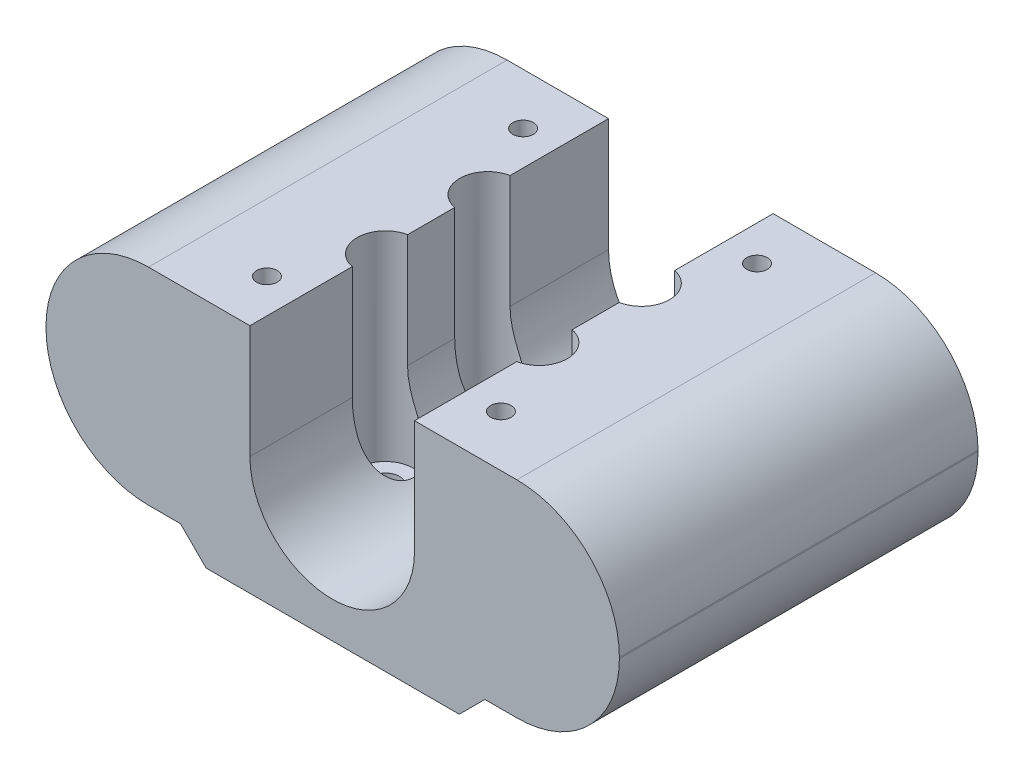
SolidWorks part; units mm, degrees
ref_plane "Front Plane" through (0, 0, 0) normal (0, 0, 1) x (1, 0, 0)
ref_plane "Top Plane" through (0, 0, 0) normal (0, 1, 0) x (1, 0, 0)
ref_plane "Right Plane" through (0, 0, 0) normal (1, 0, 0) x (0, 0, -1)
sketch "Sketch1" plane through (0, 0, 0) normal (0, 1, 0) x (1, 0, 0)
  line L1 (-10.4576, 12.6421) -> (9.5424, 12.6421)
  line L2 (-10.4576, 12.6421) -> (-10.4576, -15.3579)
  line L3 (-10.4576, -15.3579) -> (9.5424, -15.3579)
  line L4 (9.5424, 12.6421) -> (9.5424, -15.3579)
  dimension "D1" = 28
  dimension "D2" = 20
extrude "Boss-Extrude1" add sketch "Sketch1" along normal blind 18.1
sketch "Sketch3" plane through (0, 0, 15.3579) normal (0, 0, 1) x (1, 0, 0)
  line L0 (9.5424, 18.1) -> (9.5424, 0) construction
  line L1 (-10.4576, 0) -> (9.5424, 0) construction
  line L2 (-6.8826, 9.25) -> (-6.8826, 18.1)
  line L3 (-10.4576, 18.1) -> (9.5424, 18.1) construction
  line L4 (5.9674, 9.25) -> (5.9674, 18.1)
  line L5 (5.9674, 18.1) -> (-6.8826, 18.1)
  line L6 (-6.8826, 18.1) -> (5.9674, 18.1)
  circle A0 centre (-0.4576, 9.25) radius 6.425
  dimension "D1" = 12.85
  dimension "D2" = 10
  dimension "D3" = 9.25
extrude "Cut-Extrude1" cut sketch "Sketch3" against normal through all contours A0 L4 L2 M4 | A0
sketch "Sketch4" plane through (0, 18.1, 0) normal (0, -1, 0) x (1, 0, 0)
  line L1 (7.5424, -5.6421) -> (-8.4576, -5.6421)
  line L2 (7.5424, -5.6421) -> (7.5424, 8.3579)
  line L3 (7.5424, 8.3579) -> (-8.4576, 8.3579)
  line L4 (-8.4576, -5.6421) -> (-8.4576, 8.3579)
  line L5 (9.5424, -12.6421) -> (-10.4576, -12.6421) construction
  line L6 (-10.4576, -12.6421) -> (-10.4576, 15.3579) construction
  point P8 (5.5424, -2.4921)
  point P9 (5.5424, 5.2079)
  point P10 (-6.4576, 5.2079)
  point P11 (-6.4576, -2.4921)
  dimension "D1" = 7
  dimension "D2" = 14
  dimension "D3" = 16
  dimension "D4" = 2
  dimension "D5" = 2
  dimension "D6" = 2
  dimension "D7" = 2
  dimension "D8" = 2
  dimension "D9" = 3.15
  dimension "D10" = 3.15
  dimension "D11" = 3.15
  dimension "D12" = 3.15
sketch "Sketch12" plane through (0, 0, 0) normal (0, -1, 0) x (1, 0, 0)
  line L1 (-8.4576, 8.3579) -> (7.5424, 8.3579)
  line L2 (-8.4576, 8.3579) -> (-8.4576, -5.6421)
  line L3 (-8.4576, -5.6421) -> (7.5424, -5.6421)
  line L4 (7.5424, 8.3579) -> (7.5424, -5.6421)
  point P6 (-6.4576, 5.2079)
  point P7 (-6.4576, -2.4921)
  point P9 (5.5424, -2.4921)
  point P11 (5.5424, 5.2079)
sketch3d "3DSketch2"
  line L1 (-8.4576, 4, 8.3579) -> (7.5424, 4, 8.3579)
  line L2 (-8.4576, 4, 8.3579) -> (-8.4576, 4, -5.6421)
  line L3 (-8.4576, 4, -5.6421) -> (7.5424, 4, -5.6421)
  line L4 (7.5424, 4, 8.3579) -> (7.5424, 4, -5.6421)
  point P6 (-6.4576, 4, 5.2079)
  point P7 (-6.4576, 4, -2.4921)
  point P9 (5.5424, 4, 5.2079)
  point P11 (5.5424, 4, -2.4921)
  point P13 (-6.4576, 4, 5.5079)
  point P15 (5.5424, 4, 5.5079)
  dimension "D1" = 4
  dimension "D2" = 14
  dimension "D3" = 2.85
  dimension "D4" = 2.85
hole_wizard "CBORE for M2 SHCS3" positions "Sketch19" profile "Sketch20" counterbore size "M2" standard "ANSI Metric"
sketch "Sketch19" plane through (0, 18.1, 0) normal (0, 1, 0) x (1, 0, 0)
  line L0 (9.5424, 12.6421) -> (5.9674, 12.6421) construction
  line L1 (-6.8826, 12.6421) -> (-10.4576, 12.6421) construction
  point P12 (-6.4576, -5.2079)
  point P15 (5.5424, -5.2079)
  point P21 (5.5424, 2.7921)
  point P23 (-6.4576, 2.7921)
  point P30 (0, 0)
  dimension "D1" = 9.85
  dimension "D2" = 9.85
sketch "Sketch20" plane through (-6.4576, 18.1, 5.2079) normal (1, 0, 0) x (0, 0, 1)
  line L0 (0, 0) -> (0, 18.1)
  line L1 (1.1, 17.975) -> (1.225, 18.1)
  line L2 (1.1, 17.975) -> (1.1, 15.6)
  line L3 (1.1, 15.6) -> (2.2, 15.6)
  line L4 (2.2, 15.6) -> (2.2, 0)
  line L5 (2.2, 0) -> (0, 0)
  line L11 (0, -6.35) -> (0, 107.95) construction
  line L12 (1.225, 18.1) -> (0, 18.1)
  line L13 (-1.1, 17.975) -> (-1.225, 18.1) construction
  dimension "Thru Hole Dia." = 2.2
  dimension "Thru Hole Depth" = 18.1
  dimension "C'Bore Dia." = 4.4
  dimension "C'Bore Depth" = 15.6
  dimension "Far C'Sink Dia." = 2.45
  dimension "Far C'Sink Angle" = 90
sketch "Sketch21" plane through (0, 18.1, 0) normal (0, 1, 0) x (1, 0, 0)
  line L1 (9.5424, -15.3579) -> (11.4622, -15.3579)
  line L2 (9.5424, -15.3579) -> (9.5424, 12.6421)
  line L3 (9.5424, 12.6421) -> (11.4622, 12.6421)
  line L4 (11.4622, -15.3579) -> (11.4622, 12.6421)
  line L5 (-10.4576, -15.3579) -> (-12.3023, -15.3579)
  line L6 (-10.4576, -15.3579) -> (-10.4576, 12.6421)
  line L7 (-10.4576, 12.6421) -> (-12.3023, 12.6421)
  line L8 (-12.3023, -15.3579) -> (-12.3023, 12.6421)
extrude "Boss-Extrude2" add sketch "Sketch21" against normal up to surface (18.1 mm away)
sketch "Sketch22" plane through (0, 18.1, 0) normal (0, 1, 0) x (1, 0, 0)
  line L0 (5.9674, -15.3579) -> (11.4622, -15.3579) construction
  line L1 (11.4622, -15.3579) -> (11.4622, 12.6421) construction
  line L3 (-12.3023, 12.6421) -> (-12.3023, -15.3579) construction
  line L4 (-12.3023, -15.3579) -> (-6.8826, -15.3579) construction
  line L5 (-6.8826, 12.6421) -> (-12.3023, 12.6421) construction
  line L6 (11.4622, 12.6421) -> (5.9674, 12.6421) construction
  point P0 (8.7122, -11.3579)
  point P1 (8.7122, 8.6421)
  point P2 (-9.5523, -11.3579)
  point P3 (-9.5523, 8.6421)
  dimension "D1" = 4
  dimension "D2" = 2.75
  dimension "D3" = 2.75
  dimension "D4" = 4
  dimension "D5" = 4
  dimension "D6" = 4
  dimension "D7" = 2.75
  dimension "D8" = 2.75
hole_wizard "M2x0.4 Tapped Hole1" positions "Sketch23" profile "Sketch25" tap size "M2x0.4" standard "ANSI Metric"
sketch "Sketch23" plane through (0, 18.1, 0) normal (0, 1, 0) x (1, 0, 0)
  point P0 (8.7122, 8.6421)
  point P3 (8.7122, -11.3579)
  point P6 (-9.5523, -11.3579)
  point P9 (-9.5523, 8.6421)
sketch "Sketch25" plane through (8.7122, 18.1, -8.6421) normal (1, 0, 0) x (0, 0, 1)
  line L0 (0, 0) -> (0, 3.5807)
  line L1 (0, 3.5807) -> (0.8, 3.1)
  line L2 (0.8, 3.1) -> (0.8, 0)
  line L5 (0.8, 0) -> (0, 0)
  line L10 (0, 3.5807) -> (-0.8, 3.1) construction
  line L11 (0, -6.35) -> (0, 107.95) construction
  dimension "Tap Drill Dia." = 1.6
  dimension "Tap Drill Depth" = 3.1
  dimension "Drill Angle" = 118
chamfer "Chamfer2" distance 2 angle 45 2 edges at (11.4622, 0, 1.3579) (-12.3023, 0, 1.3579)
sketch "Sketch26" plane through (-12.3023, 0, 0) normal (-1, 0, 0) x (0, 0, 1)
  line L0 (-12.6421, 18.1) -> (15.3579, 18.1) construction
  line L1 (-12.6421, 2) -> (15.3579, 2)
  line L2 (-12.6421, 2) -> (-12.6421, 18.1)
  line L3 (-12.6421, 18.1) -> (15.3579, 18.1)
  line L4 (15.3579, 2) -> (15.3579, 18.1)
  dimension "D1" = 28
extrude "Boss-Extrude3" add sketch "Sketch26" along normal blind 10.5
sketch "Sketch28" plane through (0, 0, -12.6421) normal (0, 0, -1) x (-1, 0, 0)
  line L0 (6.8826, 9.25) -> (6.8826, 18.1) construction
  line L1 (6.8826, 18.1) -> (22.8023, 18.1) construction
  circle A0 centre (16.8826, 9.25) radius 4.25
  dimension "D3" = 8.5
  dimension "D1" = 10
  dimension "D2" = 8.85
extrude "Cut-Extrude2" cut sketch "Sketch28" against normal blind 19
sketch "Sketch29" plane through (11.4622, 0, 0) normal (1, 0, 0) x (0, 0, -1)
  line L0 (-15.3579, 2) -> (12.6421, 2) construction
  line L1 (12.6421, 18.1) -> (-15.3579, 18.1)
  line L2 (12.6421, 18.1) -> (12.6421, 2)
  line L3 (12.6421, 2) -> (-15.3579, 2)
  line L4 (-15.3579, 18.1) -> (-15.3579, 2)
  dimension "D1" = 28
extrude "Boss-Extrude4" add sketch "Sketch29" along normal blind 10.5
sketch "Sketch30" plane through (0, 0, -12.6421) normal (0, 0, -1) x (-1, 0, 0)
  line L0 (-21.9622, 18.1) -> (-5.9674, 18.1) construction
  line L2 (-5.9674, 9.25) -> (-5.9674, 18.1) construction
  line L3 (-15.9674, 9.25) -> (16.8826, 9.25) construction
  circle A0 centre (-15.9674, 9.25) radius 4.25
  point P6 (0.4576, 9.25)
  dimension "D1" = 8.5
  dimension "D2" = 8.85
  dimension "D3" = 10
extrude "Cut-Extrude3" cut sketch "Sketch30" against normal blind 19
fillet "Fillet1" radius 8 4 edges at (21.9622, 18.1, 1.3579) (21.9622, 2, 1.3579) (-22.8023, 2, 1.3579) (-22.8023, 18.1, 1.3579)
